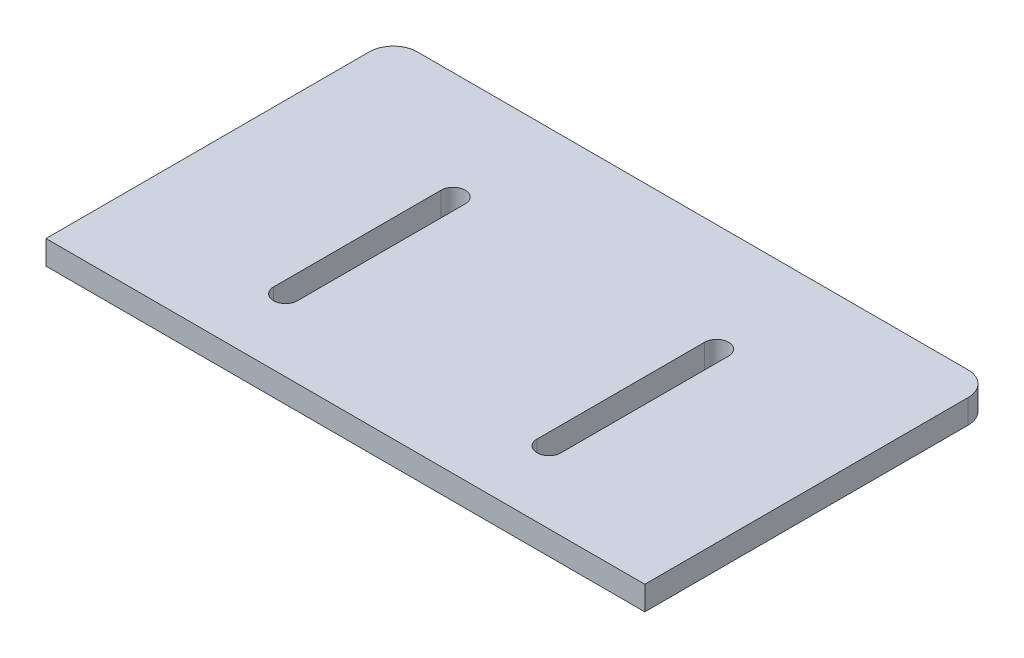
SolidWorks part; units mm, degrees
ref_plane "Plano frontal" through (0, 0, 0) normal (0, 0, 1) x (1, 0, 0)
ref_plane "Plano superior" through (0, 0, 0) normal (0, 1, 0) x (1, 0, 0)
ref_plane "Plano direito" through (0, 0, 0) normal (1, 0, 0) x (0, 0, -1)
sketch "Esboço1" plane through (0, 0, 0) normal (0, 1, 0) x (1, 0, 0)
  line L0 (-11, 5.5) -> (-11, -8.5) construction
  line L1 (-23, 14.5) -> (23, 14.5)
  line L2 (-25, 12.5) -> (-25, -14.5)
  line L3 (-25, -14.5) -> (25, -14.5)
  line L4 (25, 12.5) -> (25, -14.5)
  line L5 (-25, 14.5) -> (25, -14.5) construction
  line L6 (-25, -14.5) -> (25, 14.5) construction
  line L7 (-10, 5.5) -> (-10, -8.5)
  line L8 (-12, 5.5) -> (-12, -8.5)
  line L9 (0, 0) -> (0, 11.4482) construction
  line L10 (11, 5.5) -> (11, -8.5) construction
  line L11 (10, 5.5) -> (10, -8.5)
  line L12 (12, 5.5) -> (12, -8.5)
  arc A0 (-10, 5.5) -> (-12, 5.5) centre (-11, 5.5) ccw
  arc A1 (-12, -8.5) -> (-10, -8.5) centre (-11, -8.5) ccw
  arc A2 (10, 5.5) -> (12, 5.5) centre (11, 5.5) cw
  arc A3 (12, -8.5) -> (10, -8.5) centre (11, -8.5) cw
  arc A4 (23, 14.5) -> (25, 12.5) centre (23, 12.5) cw
  arc A5 (-23, 14.5) -> (-25, 12.5) centre (-23, 12.5) ccw
  point P0 (0, 0)
  point P8 (-11, -1.5)
  point P17 (11, -1.5)
  dimension "D4" = 16
  dimension "D7" = 2
  dimension "D1" = 50
  dimension "D2" = 29
  dimension "D3" = 2
  dimension "D5" = 5
  dimension "D6" = 10
extrude "Ressalto-extrusão1" add sketch "Esboço1" along normal blind 2
